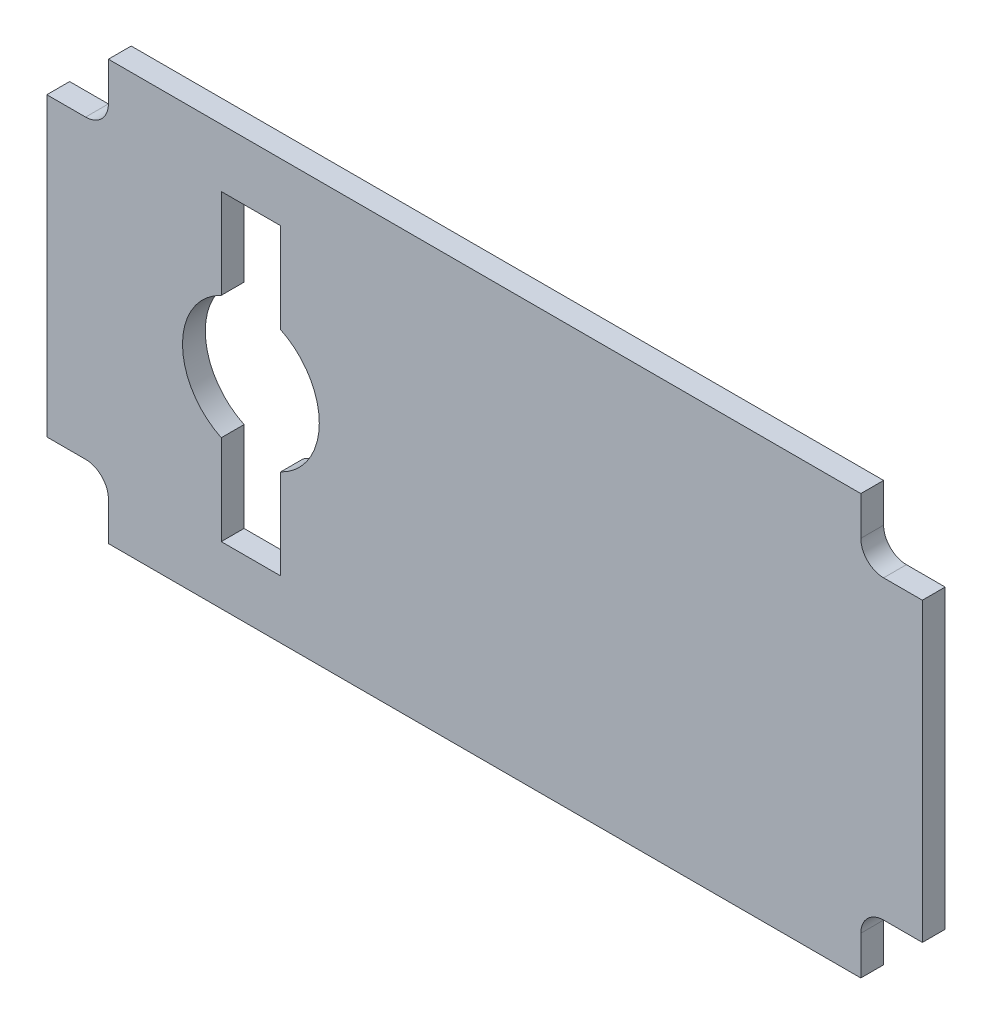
SolidWorks part; units mm, degrees
ref_plane "Přední" through (0, 0, 0) normal (0, 0, 1) x (1, 0, 0)
ref_plane "Horní" through (0, 0, 0) normal (0, 1, 0) x (1, 0, 0)
ref_plane "Pravá" through (0, 0, 0) normal (1, 0, 0) x (0, 0, -1)
sketch "Skica1" plane through (0, 0, 0) normal (0, 0, 1) x (1, 0, 0)
  line L0 (-16.5, -9.2) -> (16.5, -9.2) construction
  line L1 (16.5, -7.85) -> (16.5, -9.2) construction
  line L2 (19.2, -6.5) -> (19.2, 6.5) construction
  line L3 (19.2, -6.5) -> (17.85, -6.5) construction
  line L4 (-16.5, -9.2) -> (16.5, -9.2)
  line L5 (16.5, -7.5) -> (16.5, -9.2)
  line L6 (19.2, -6.5) -> (19.2, 6.5)
  line L7 (19.2, -6.5) -> (17.5, -6.5)
  line L8 (16.5, 9.2) -> (-16.5, 9.2) construction
  line L9 (-16.5, 7.85) -> (-16.5, 9.2) construction
  line L10 (-19.2, 6.5) -> (-17.85, 6.5) construction
  line L11 (-19.2, 6.5) -> (-19.2, -6.5) construction
  line L12 (16.5, 9.2) -> (-16.5, 9.2)
  line L13 (-16.5, 7.5) -> (-16.5, 9.2)
  line L14 (-19.2, 6.5) -> (-17.5, 6.5)
  line L15 (-19.2, 6.5) -> (-19.2, -6.5)
  line L16 (-17.85, -6.5) -> (-19.2, -6.5) construction
  line L17 (-16.5, -9.2) -> (-16.5, -7.85) construction
  line L18 (-17.5, -6.5) -> (-19.2, -6.5)
  line L19 (-16.5, -9.2) -> (-16.5, -7.5)
  line L20 (17.85, 6.5) -> (19.2, 6.5) construction
  line L21 (16.5, 9.2) -> (16.5, 7.85) construction
  line L22 (17.5, 6.5) -> (19.2, 6.5)
  line L23 (16.5, 9.2) -> (16.5, 7.5)
  line L24 (-10.25, 5.6295) -> (-10.25, -5.638) construction
  line L25 (-15.4721, 0) -> (-5.789, 0) construction
  line L26 (-11.55, 2.7037) -> (-11.55, 6.65)
  line L27 (-8.95, 2.7037) -> (-8.95, 6.65)
  line L28 (-11.55, 6.65) -> (-8.95, 6.65)
  line L29 (-11.55, -6.65) -> (-8.95, -6.65)
  line L30 (-8.95, -6.65) -> (-8.95, -2.7037)
  line L31 (-11.55, -6.65) -> (-11.55, -2.7037)
  arc A0 (17.5, 6.5) -> (16.5, 7.5) centre (17.5, 7.5) cw
  arc A1 (16.547, 7.803) -> (17.803, 6.547) centre (17.5, 7.5) ccw construction
  arc A2 (16.5, -7.5) -> (17.5, -6.5) centre (17.5, -7.5) cw
  arc A3 (-17.5, -6.5) -> (-16.5, -7.5) centre (-17.5, -7.5) cw
  arc A4 (-16.5, 7.5) -> (-17.5, 6.5) centre (-17.5, 7.5) cw
  arc A5 (-11.55, 2.7037) -> (-11.55, -2.7037) centre (-10.25, 0) ccw
  arc A6 (-3.9, -5.8737) -> (-3.9, 5.8737) centre (-10.25, 0) ccw construction
  arc A7 (-8.95, -2.7037) -> (-8.95, 2.7037) centre (-10.25, 0) ccw
  dimension "D1" = 6
  dimension "D2" = 13.3
  dimension "D3" = 2.6
extrude "Základ-Protažení" add sketch "Skica1" along normal blind 1
